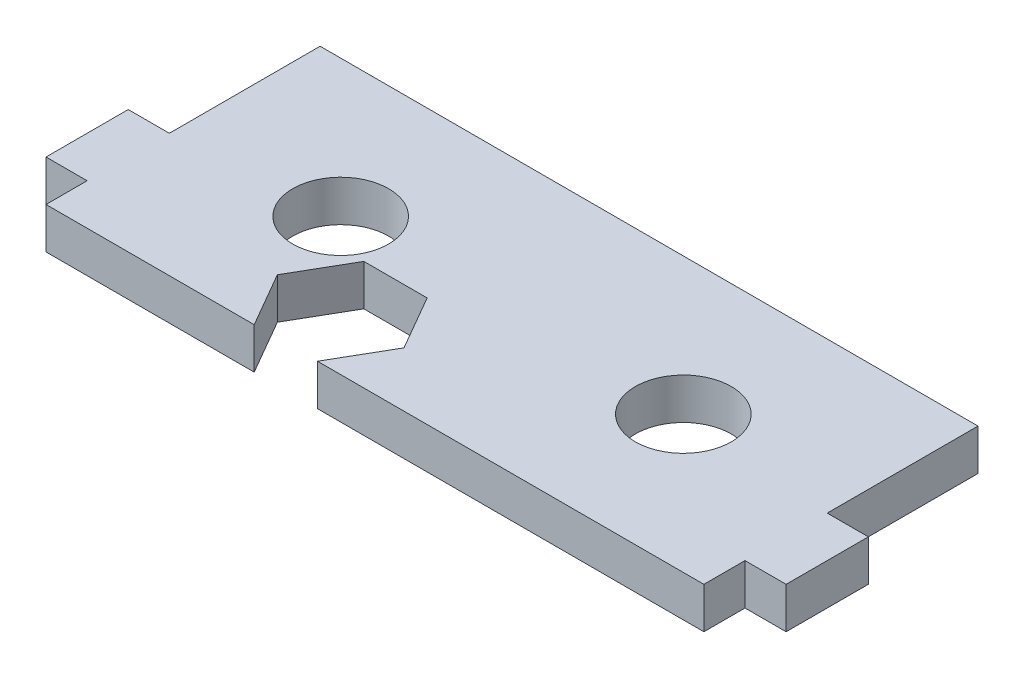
SolidWorks part; units mm, degrees
ref_plane "Front Plane" through (0, 0, 0) normal (0, 0, 1) x (1, 0, 0)
ref_plane "Top Plane" through (0, 0, 0) normal (0, 1, 0) x (1, 0, 0)
ref_plane "Right Plane" through (0, 0, 0) normal (1, 0, 0) x (0, 0, -1)
sketch "Sketch1" plane through (0, 0, 0) normal (0, 1, 0) x (1, 0, 0)
  line L1 (-24, 10) -> (24, 10)
  line L2 (-24, 10) -> (-24, -10)
  line L3 (-24, -10) -> (24, -10)
  line L4 (24, 10) -> (24, -10)
  line L5 (-24, 10) -> (24, -10) construction
  line L6 (-24, -10) -> (24, 10) construction
  point P0 (0, 0)
  dimension "D1" = 48
  dimension "D2" = 20
extrude "Boss-Extrude1" add sketch "Sketch1" along normal blind 3
sketch "Sketch2" plane through (0, 0, 0) normal (0, 1, 0) x (1, 0, 0)
  line L0 (-24, 10) -> (-24, -10) construction
  line L1 (-24, -4) -> (-25.5, -4) construction
  line L2 (0, 0) -> (0, 3.5408) construction
  line L3 (-24, -10) -> (24, -10) construction
  line L4 (-27, -1) -> (-24, -1)
  line L5 (-27, -1) -> (-27, -7)
  line L6 (-27, -7) -> (-24, -7)
  line L7 (-24, -1) -> (-24, -7)
  line L8 (-27, -1) -> (-24, -7) construction
  line L9 (-27, -7) -> (-24, -1) construction
  line L10 (27, -1) -> (24, -7) construction
  line L11 (24, -4) -> (25.5, -4) construction
  line L12 (24, -1) -> (24, -7)
  line L13 (27, -7) -> (24, -7)
  line L14 (27, -1) -> (27, -7)
  line L15 (27, -1) -> (24, -1)
  dimension "D1" = 3
  dimension "D2" = 3
  dimension "D3" = 6
extrude "Boss-Extrude2" add sketch "Sketch2" along normal blind 3
sketch "Sketch3" plane through (0, 0, 0) normal (0, 1, 0) x (1, 0, 0)
  line L0 (0, 0) -> (0, -6) construction
  line L1 (0, -6) -> (-6.5, -6) construction
  line L2 (-6.5, -6) -> (-6.5, -10) construction
  line L3 (-4.1906, -2) -> (-8.8094, -2)
  line L4 (-8.8094, -2) -> (-11.1188, -6)
  line L5 (-11.1188, -6) -> (-8.8094, -10)
  line L6 (-8.8094, -10) -> (-4.1906, -10)
  line L7 (-4.1906, -10) -> (-1.8812, -6)
  line L8 (-1.8812, -6) -> (-4.1906, -2)
  line L9 (-24, -10) -> (24, -10) construction
  line L10 (-12.5, 0) -> (12.5, 0) construction
  circle A0 centre (-6.5, -6) radius 4 construction
  circle A1 centre (-12.5, 0) radius 3.5
  circle A2 centre (12.5, 0) radius 3.5
  point P18 (0, 0)
  dimension "D3" = 7
  dimension "D4" = 25
  dimension "D1" = 6.5
  dimension "D2" = 6
extrude "Cut-Extrude1" cut sketch "Sketch3" along normal blind 3
